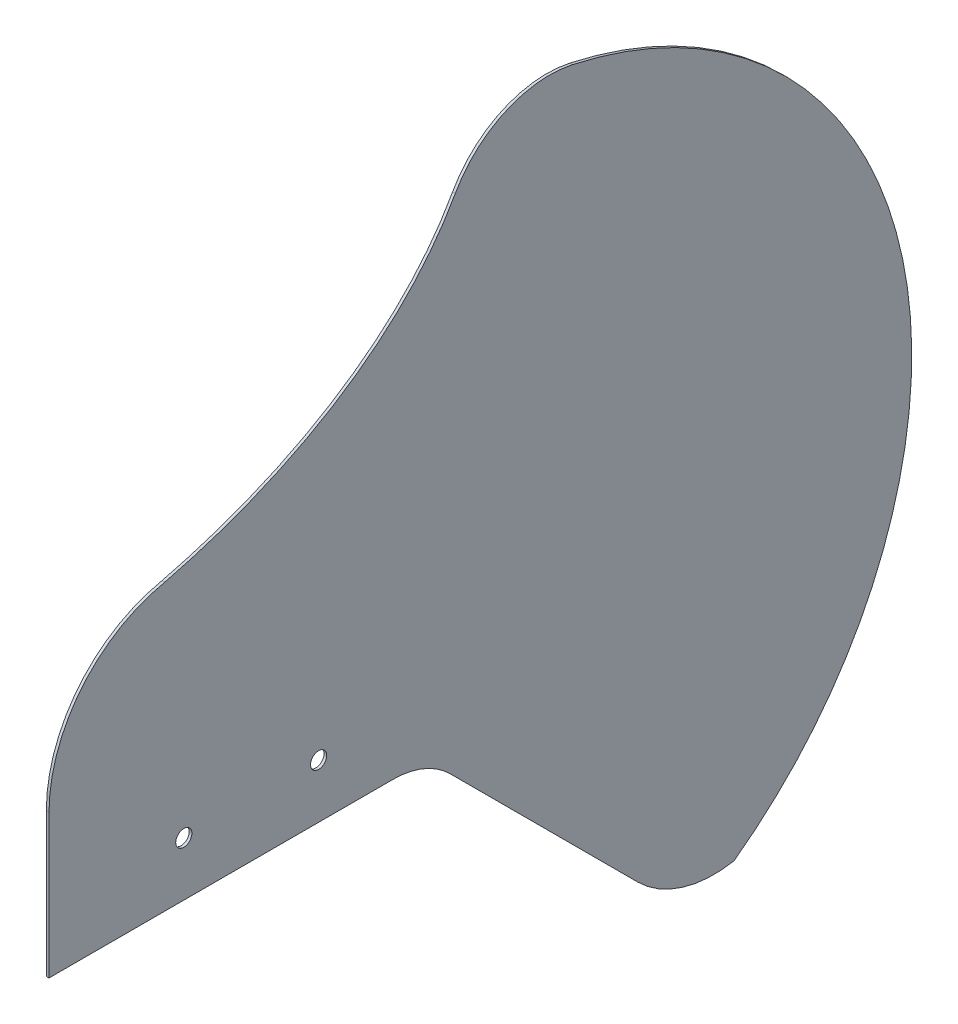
SolidWorks part; units mm, degrees
ref_plane "Plan de face" through (0, 0, 0) normal (0, 0, 1) x (1, 0, 0)
ref_plane "Plan de dessus" through (0, 0, 0) normal (0, 1, 0) x (1, 0, 0)
ref_plane "Plan de droite" through (0, 0, 0) normal (1, 0, 0) x (0, 0, -1)
sketch "Esquisse1" plane through (0, 0, 0) normal (1, 0, 0) x (0, 0, -1)
  line L0 (-130.2273, 0) -> (88.5166, 0) construction
  line L1 (-80, -101.2881) -> (-80, 51.5458) construction
  line L2 (-112.4529, -20) -> (15.049, -20) construction
  line L3 (0, 91.8345) -> (0, -13.1531) construction
  line L4 (-112.4529, 20) -> (15.049, 20) construction
  line L5 (-10, -6.2803) -> (-10, -101.2881) construction
  line L6 (-10, -20) -> (64.4001, -94.4001) construction
  line L7 (-80, 0) -> (-80, -20)
  line L8 (-80, -20) -> (-16.2132, -20)
  line L9 (-5.6066, -24.3934) -> (29.1956, -59.1956)
  line L10 (-80, 20) -> (0, 80) construction
  line L11 (-80, 0) -> (-80, 6.6241)
  line L12 (-86.8794, -10) -> (-2.9627, -10) construction
  line L13 (-55, -33.5898) -> (-55, -3.1936) construction
  line L14 (-30, -33.5898) -> (-30, -3.1936) construction
  arc A0 (47.042, -64.7074) -> (17.1014, 78.1508) centre (0, 0) ccw
  arc A1 (-58.5395, 32.8474) -> (-80, 6.6241) centre (-53.2482, 6.6241) ccw
  arc A2 (17.1014, 78.1508) -> (-4.653, 68.3333) centre (12.8261, 58.6131) ccw
  arc A3 (-5.6066, -24.3934) -> (-16.2132, -20) centre (-16.2132, -35) ccw
  arc A4 (29.1956, -59.1956) -> (47.042, -64.7074) centre (43.3377, -45.0534) ccw
  circle A5 centre (-55, -10) radius 1.5
  circle A6 centre (-30, -10) radius 1.5
  spline S0 degree 3 poles (-58.5395, 32.8474) (-46.3241, 35.8723) (-24.1626, 45.0166) (-9.4348, 59.7346) (-4.653, 68.3333) knots 0 0 0 0 0.345586 0.691172 0.691172 0.691172 0.691172
  dimension "D1" = 20
  dimension "D5" = 20
  dimension "D6" = 10
  dimension "D2" = 20
  dimension "D3" = 70
  dimension "D4" = 45
  dimension "D7" = 25
  dimension "D8" = 25
extrude "Extrusion1" add sketch "Esquisse1" along normal blind 0.5
